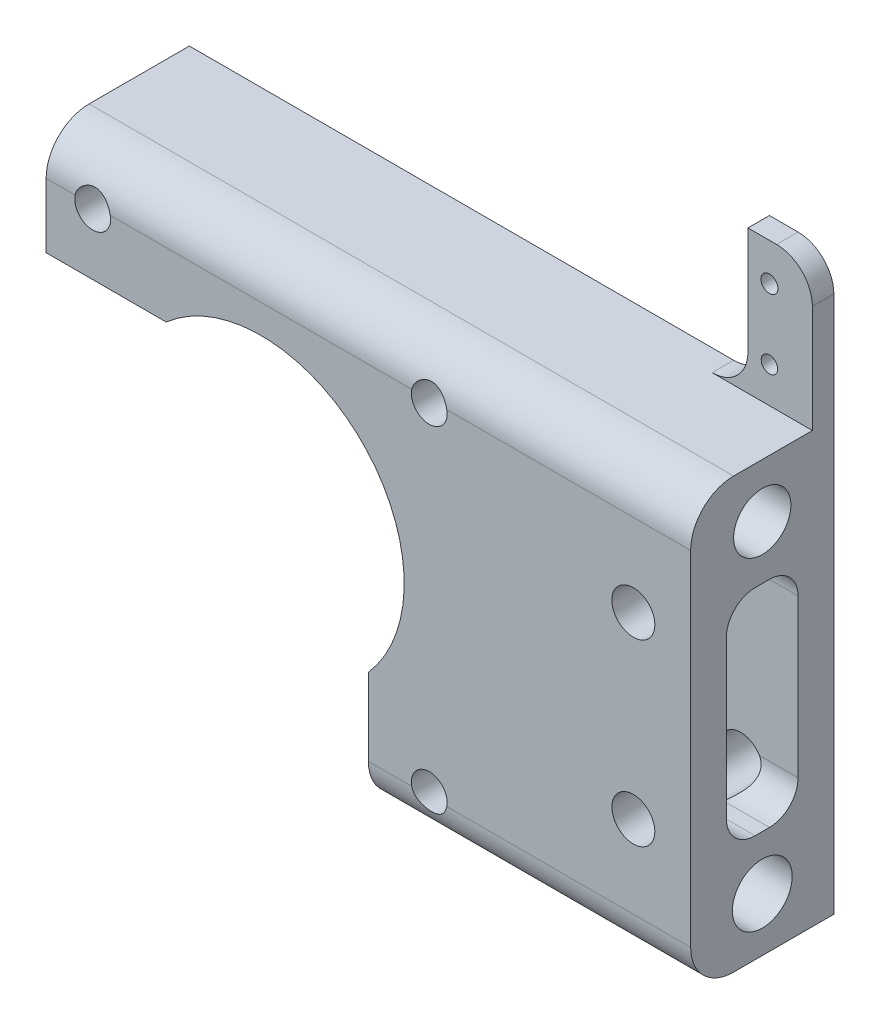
SolidWorks part; units mm, degrees
ref_plane "Alzado" through (0, 0, 0) normal (0, 0, 1) x (1, 0, 0)
ref_plane "Planta" through (0, 0, 0) normal (0, 1, 0) x (1, 0, 0)
ref_plane "Vista lateral" through (0, 0, 0) normal (1, 0, 0) x (0, 0, -1)
sketch "Croquis1" plane through (0, 0, 0) normal (0, 0, 1) x (1, 0, 0)
  line L0 (0, 60) -> (-50, 60)
  line L1 (0, 0) -> (40, 0)
  line L2 (0, 0) -> (0, 60) construction
  line L3 (0, 60) -> (40, 60)
  line L4 (40, 0) -> (40, 60)
  line L6 (-50, 60) -> (-50, 45)
  line L7 (-50, 45) -> (-33.2288, 45)
  line L9 (3.5, 53.5) -> (-43.5, 53.5) construction
  line L10 (3.5, 53.5) -> (3.5, 6.5) construction
  line L11 (3.5, 6.5) -> (-43.5, 6.5) construction
  line L12 (-43.5, 53.5) -> (-43.5, 6.5) construction
  line L13 (-5, 16.7712) -> (-5, 0)
  line L14 (-5, 0) -> (0, 0)
  line L15 (3.5, 53.5) -> (-43.5, 6.5) construction
  line L16 (3.5, 6.5) -> (-43.5, 53.5) construction
  arc A0 (-5, 16.7712) -> (-33.2288, 45) centre (-20, 30) ccw
  circle A1 centre (-43.5, 53.5) radius 2.5
  circle A2 centre (3.5, 53.5) radius 2.5
  circle A3 centre (3.5, 6.5) radius 2.5
  dimension "D3" = 40
  dimension "D5" = 5
  dimension "D10" = 30
  dimension "D1" = 60
  dimension "D2" = 40
  dimension "D4" = 47
  dimension "D6" = 90
  dimension "D7" = 15
  dimension "D8" = 20
extrude "Saliente-Extruir1" add sketch "Croquis1" along normal blind 20
sketch "Croquis2" plane through (40, 0, 0) normal (-1, 0, 0) x (0, 0, 1)
  line L0 (5, 30) -> (0, 30) construction
  line L1 (5, 45) -> (15, 45)
  line L2 (5, 45) -> (5, 15)
  line L3 (5, 15) -> (15, 15)
  line L4 (15, 45) -> (15, 15)
  line L6 (10, 45) -> (10, 52.5) construction
  line L7 (10, 7.5) -> (10, 15) construction
  line L8 (15, 30) -> (20, 30) construction
  line L11 (20, 16.7712) -> (20, 50) construction
  line L12 (0, 50) -> (0, 16.7712) construction
  line L13 (20, 60) -> (0, 60) construction
  circle A0 centre (10, 52.5) radius 4
  circle A1 centre (10, 7.5) radius 4.1789
  point P10 (0, 29.8898)
  point P16 (0, 0)
  point P17 (20, 30)
  dimension "D1" = 8
  dimension "D4" = 45
  dimension "D2" = 30
  dimension "D3" = 10
  dimension "D5" = 30
extrude "Cortar-Extruir1" cut sketch "Croquis2" along normal through all contours L1 L4 L3 L2 | A0 | A1
fillet "Redondeo1" radius 4 4 edges at (17.5, 15, 5) (17.5, 15, 15) (16.6144, 45, 15) (16.6144, 45, 5)
sketch "Croquis3" plane through (0, 0, 20) normal (0, 0, 1) x (1, 0, 0)
  line L4 (40, 60) -> (-50, 60) construction
  line L5 (-5, 0) -> (40, 0) construction
  line L6 (32, 42.5) -> (32, 60) construction
  line L7 (32, 42.5) -> (32, 17.5) construction
  line L8 (32, 17.5) -> (32, 0) construction
  line L9 (32, 17.5) -> (40, 17.5) construction
  line L10 (40, 0) -> (40, 60) construction
  line L11 (32, 42.5) -> (40, 42.5) construction
  circle A1 centre (32, 42.5) radius 3
  circle A2 centre (32, 17.5) radius 3
  dimension "D3" = 6
  dimension "D4" = 25
  dimension "D5" = 8
extrude "Cortar-Extruir2" cut sketch "Croquis3" against normal through all
fillet "Redondeo2" radius 6 2 edges at (17.5, 0, 20) (-5, 60, 20)
sketch "Croquis4" plane through (0, 60, 0) normal (0, 1, 0) x (1, 0, 0)
  line L1 (40, 0) -> (31, 0)
  line L2 (40, 0) -> (40, -3)
  line L3 (40, -3) -> (31, -3)
  line L4 (31, 0) -> (31, -3)
  dimension "D1" = 9
  dimension "D2" = 3
extrude "Saliente-Extruir2" add sketch "Croquis4" along normal blind 20
fillet "Redondeo3" radius 5 2 edges at (31, 60, 1.5) (40, 80, 1.5)
sketch "Croquis5" plane through (0, 0, 0) normal (0, 0, -1) x (-1, 0, 0)
  circle A0 centre (-34.0025, 65) radius 1.1473
  circle A1 centre (-34, 74.75) radius 1.184
extrude "Cortar-Extruir3" cut sketch "Croquis5" against normal blind 20
